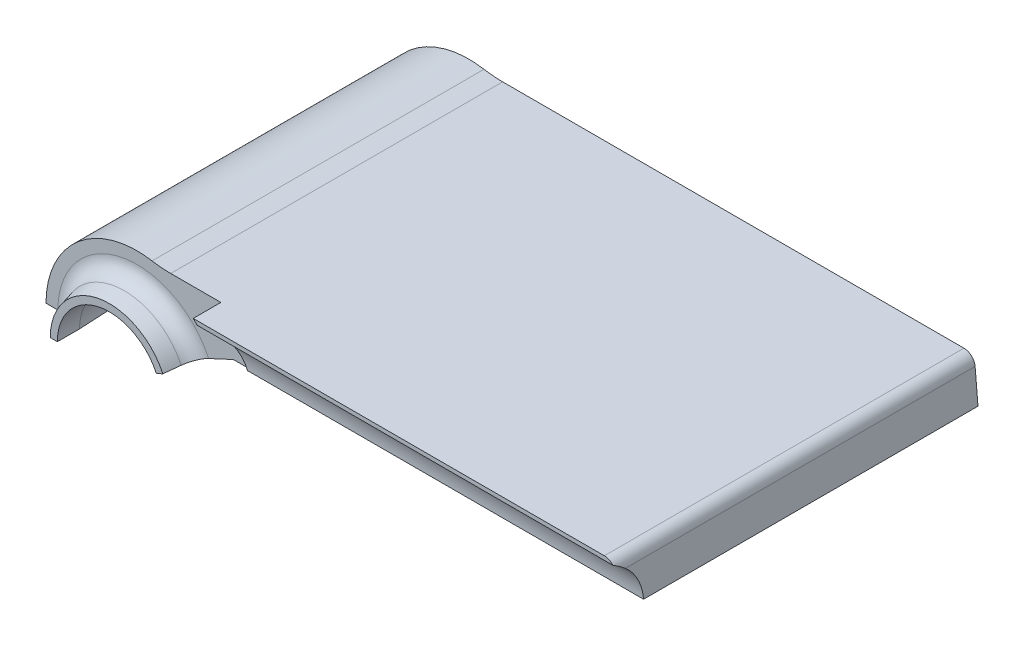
SolidWorks part; units mm, degrees
ref_plane "Plan1" through (0, 0, 0) normal (0, 0, 1) x (1, 0, 0)
ref_plane "Plan2" through (0, 0, 0) normal (0, 1, 0) x (1, 0, 0)
ref_plane "Plan3" through (0, 0, 0) normal (1, 0, 0) x (0, 0, -1)
sketch "Esquisse1" plane through (0, 0, 0) normal (0, 0, 1) x (1, 0, 0)
  line L0 (-20, 0) -> (30, 0) construction
  line L1 (-20, 8.12) -> (103.692, 8.12) construction
  line L2 (6.1008, 15.935) -> (89.4898, 15.935)
  line L3 (91.5121, 14.0819) -> (92.0337, 8.12)
  line L4 (91.5121, 2.1581) -> (92.0337, 8.12)
  line L5 (30.8285, 0.305) -> (89.4898, 0.305)
  arc A0 (2.7304, 16.2168) -> (13.7971, -8.9486) centre (0, 0) ccw
  arc A1 (89.4898, 15.935) -> (91.5121, 14.0819) centre (89.4898, 13.905) cw
  arc A2 (89.4898, 0.305) -> (91.5121, 2.1581) centre (89.4898, 2.335) ccw
  arc A3 (30.8285, 0.305) -> (13.7971, -8.9486) centre (30.8285, -19.995) ccw
  arc A4 (2.7304, 16.2168) -> (6.1008, 15.935) centre (6.1008, 36.235) ccw
  point P4 (0, 0)
  point P12 (91.35, 15.935)
  dimension "D1" = 32.89
  dimension "D6" = 2.03
  dimension "D7" = 20.3
  dimension "D8" = 20.3
  dimension "D2" = 8.12
  dimension "D3" = 7.815
  dimension "D4" = 85
  dimension "D5" = 91.35
extrude "Base-Extrusion" add sketch "Esquisse1" along normal blind 65
sketch "Esquisse3" plane through (0, 0, 0) normal (0, 1, 0) x (1, 0, 0)
  line L0 (0, 7.8237) -> (0, -74.996) construction
  line L1 (0, -65) -> (0, 0) construction
  line L2 (10.68, -65) -> (11.352, -62.3046)
  line L3 (-16.445, -65) -> (13.7971, -65) construction
  line L4 (14.3017, -60) -> (22, -60)
  line L5 (22, -60) -> (22, -65)
  line L6 (30.8285, -65) -> (89.4898, -65) construction
  line L7 (22, -65) -> (10.68, -65)
  arc A0 (14.3017, -60) -> (11.352, -62.3046) centre (14.3017, -63.04) ccw
  dimension "D5" = 3.04
  dimension "D1" = 14
  dimension "D2" = 5
  dimension "D3" = 21.36
  dimension "D4" = 22
revolve "Enlèvement de matière-Révolution2" cut sketch "Esquisse3" angle 360 about L0
ref_plane "Plan4" through (95, 0, 0) normal (1, 0, 0) x (0, 0, -1)
sketch "Esquisse4" plane through (95, 0, 0) normal (1, 0, 0) x (0, 0, -1)
  line L1 (-68.27, 26.2142) -> (-68.27, -28.3196) construction
  line L2 (-65, 2.1581) -> (-65, 8.12) construction
  line L3 (-84.4515, 8.12) -> (-48.1681, 8.12) construction
  line L4 (-65, 8.12) -> (0, 8.12) construction
  circle A0 centre (-68.27, 8.12) radius 7.815
  dimension "D2" = 15.63
  dimension "D1" = 3.27
extrude "Enlèv. mat.-Extru.1" cut sketch "Esquisse4" against normal up to next
sketch "Esquisse5" plane through (0, 0, 65) normal (0, 0, 1) x (1, 0, 0)
  circle A0 centre (0, 0) radius 9.39
  dimension "D1" = 18.78
extrude "Enlèv. mat.-Extru.2" cut sketch "Esquisse5" against normal blind 4
sketch "Esquisse6" plane through (0, 0, 61) normal (0, 0, 1) x (1, 0, 0)
  circle A1 centre (0, 0) radius 9.39
  circle A2 centre (0, 0) radius 9.39
  dimension "D1" = 0
extrude "Enlèv. mat.-Extru.3" cut sketch "Esquisse6" against normal through all draft 3
hole_wizard "Perçage1" positions "Esquisse11" profile "Esquisse10" hole size "M10" standard "ISO"
sketch "Esquisse11" plane through (0, 0, 0) normal (0, 0, -1) x (-1, 0, 0)
  line L0 (-92.0337, 8.12) -> (-20.8231, 8.12) construction
  line L1 (32.1503, 8.12) -> (-14.9626, 8.12) construction
  point P0 (-30, 8.12)
  dimension "D1" = 30
sketch "Esquisse10" plane through (30, 8.12, 0) normal (1, 0, 0) x (0, 1, 0)
  line L0 (0, 0) -> (0, 50.4537)
  line L1 (0, 50.4537) -> (4.25, 48)
  line L2 (4.25, 48) -> (4.25, 0)
  line L5 (4.25, 0) -> (0, 0)
  line L10 (0, 50.4537) -> (-4.25, 48) construction
  line L11 (0, -6.35) -> (0, 107.95) construction
  dimension "Diamètre du perçage" = 8.5
  dimension "Profondeur du perçage" = 48
  dimension "Angle de pointe" = 120
hole_wizard "Perçage2" positions "Esquisse13" profile "Esquisse12" hole size "M10" standard "ISO"
sketch "Esquisse13" plane through (0, 0, 0) normal (0, 0, -1) x (-1, 0, 0)
  line L0 (-94.139, 8.12) -> (-44.9902, 8.12) construction
  line L1 (32.1503, 8.12) -> (-14.9626, 8.12) construction
  point P0 (-75, 8.12)
  dimension "D1" = 45
sketch "Esquisse12" plane through (75, 8.12, 0) normal (1, 0, 0) x (0, 1, 0)
  line L0 (0, 0) -> (0, 50.4537)
  line L1 (0, 50.4537) -> (4.25, 48)
  line L2 (4.25, 48) -> (4.25, 0)
  line L5 (4.25, 0) -> (0, 0)
  line L10 (0, 50.4537) -> (-4.25, 48) construction
  line L11 (0, -6.35) -> (0, 107.95) construction
  dimension "Diamètre du perçage" = 8.5
  dimension "Profondeur du perçage" = 48
  dimension "Angle de pointe" = 120
sketch "Esquisse14" plane through (0, 0, 65) normal (0, 0, 1) x (1, 0, 0)
  line L0 (-21.0076, 0) -> (0, 0)
  line L1 (0, 0) -> (17.4134, 8.12)
  line L2 (-32.1503, 8.12) -> (14.9626, 8.12) construction
  line L3 (17.4134, 8.12) -> (97.0844, 8.12)
  dimension "D1" = 25
extrude "Enlèv. mat.-Extru.4" cut sketch "Esquisse14" against normal through all flip side to cut
